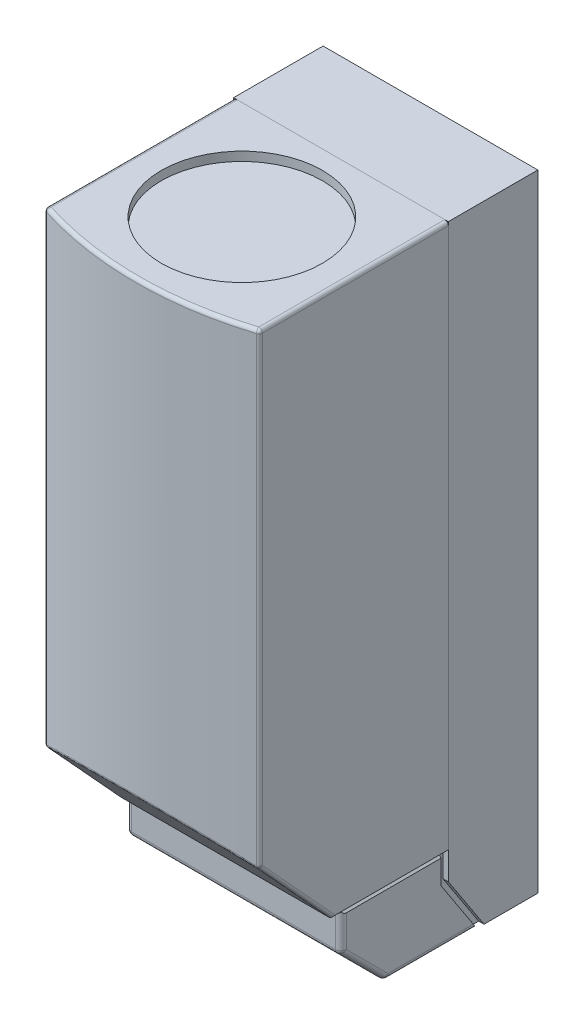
SolidWorks part; units mm, degrees
ref_plane "Ön Düzlem" through (0, 0, 0) normal (0, 0, 1) x (1, 0, 0)
ref_plane "Üst Düzlem" through (0, 0, 0) normal (0, 1, 0) x (1, 0, 0)
ref_plane "Sağ Düzlem" through (0, 0, 0) normal (1, 0, 0) x (0, 0, -1)
sketch "Çizim1" plane through (0, 0, 0) normal (0, 0, 1) x (1, 0, 0)
  line L1 (60, -175) -> (-60, -175)
  line L2 (60, -175) -> (60, 175)
  line L3 (60, 175) -> (-60, 175)
  line L4 (-60, -175) -> (-60, 175)
  line L5 (60, -175) -> (-60, 175) construction
  line L6 (60, 175) -> (-60, -175) construction
  point P0 (0, 0)
  dimension "D1" = 350
  dimension "D2" = 120
extrude "Yükseklik-Ekstrüzyon1" add sketch "Çizim1" along normal blind 50
sketch "Çizim2" plane through (0, 0, 50) normal (0, 0, 1) x (1, 0, 0)
  line L0 (60, -175) -> (60, 175) construction
  line L1 (-60, -175) -> (60, -175)
  line L2 (-60, -175) -> (-60, -130)
  line L3 (-60, -130) -> (60, -130)
  line L4 (60, -175) -> (60, -130)
  dimension "D1" = 45
extrude "Yükseklik-Ekstrüzyon2" add sketch "Çizim2" along normal blind 60
sketch "Çizim3" plane through (0, 0, 50) normal (0, 0, 1) x (1, 0, 0)
  line L4 (-60, -130) -> (60, -130)
  line L5 (60, -130) -> (60, 175)
  line L6 (60, 175) -> (-60, 175)
  line L7 (-60, 175) -> (-60, -130)
  line L8 (-60, -130) -> (60, -130)
  line L9 (60, -130) -> (60, 175)
  line L10 (60, 175) -> (-60, 175)
  line L11 (-60, 175) -> (-60, -130)
  dimension "D1" = 0
extrude "Yükseklik-Ekstrüzyon3" add sketch "Çizim3" along normal blind 120 separate body
chamfer "Pah1" distance 25 angle 45 1 edges at (0, -175, 110)
chamfer "Pah2" distance 55 distance2 60 1 edges at (0, -130, 170)
sketch "Çizim4" plane through (0, 175, 0) normal (0, 1, 0) x (1, 0, 0)
  line L0 (-60, -170) -> (-60, -50) construction
  line L1 (60, -170) -> (60, -50) construction
  line L3 (-60, -155.3713) -> (-60, -181.1023)
  line L4 (-60, -181.1023) -> (60, -181.1023)
  line L5 (60, -181.1023) -> (60, -155.3713)
  arc A0 (-60, -155.3713) -> (60, -155.3713) centre (0, 29.5734) ccw
extrude "Kes-Ekstrüzyon1" cut sketch "Çizim4" against normal blind 313
sketch "Çizim5" plane through (-60, 0, 0) normal (-1, 0, 0) x (0, 0, 1)
  line L0 (50, -144.5116) -> (54, -144.5116)
  line L1 (50, -130) -> (54, -130)
  line L2 (50, -130) -> (50, -144.5116)
  line L3 (50, -144.5116) -> (54, -144.5116)
  line L4 (54, -130) -> (54, -144.5116)
  line L5 (50, -144.5116) -> (29.1388, -176.3995)
  line L6 (54, -144.5116) -> (33.1388, -176.3995)
  line L8 (29.1388, -176.3995) -> (33.1388, -176.3995)
  dimension "D1" = 4
extrude "Kes-Ekstrüzyon2" cut sketch "Çizim5" against normal blind 3 contours L6 L0 L5 M2 | L4 L2 L0 M5
chamfer "Pah3" distance 1 angle 45 2 edges at (0, -130, 110) (-60, -130, 82)
chamfer "Pah4" distance 1 angle 45 2 edges at (-60, -130, 82.5) (60, -130, 82.5)
chamfer "Pah5" distance 1 angle 45 1 edges at (60, -130, 79.5)
fillet "Radyus1" radius 2 8 edges at (-60, 175, 102.6856) (60, 175, 102.6856) (0, 175, 164.8605) (60, -107.4793, 135.644) (0, -75.6067, 164.8605) (-60, -107.4793, 135.644) (60, 44.5207, 155.3713) (-60, 44.5207, 155.3713)
fillet "Radyus2" radius 3 6 edges at (60, -162.5, 97.5) (60, -140.5, 110) (-60, -140.5, 110) (-60, -175, 59.5272) (-60, -162.5, 97.5) (0, -150, 110)
mirror "Aynalama1" about plane through (0, 0, 0) normal (1, 0, 0) of "Kes-Ekstrüzyon2"
fillet "Radyus3" radius 3 4 edges at (-59.1213, -174.1213, 84.636) (0, -175, 85) (59.1213, -175, 83.7574) (60, -175, 57.4059)
sketch "Çizim8" plane through (0, 175, 0) normal (0, 1, 0) x (1, 0, 0)
  line L0 (0, -45.8605) -> (0, -164.8605) construction
  arc A0 (-58.6028, -155.8188) -> (58.6028, -155.8188) centre (0, 29.5734) ccw construction
  circle A1 centre (0, -105.3605) radius 45
  dimension "D2" = 90
  dimension "D1" = 119
extrude "Kes-Ekstrüzyon3" cut sketch "Çizim8" against normal blind 5
